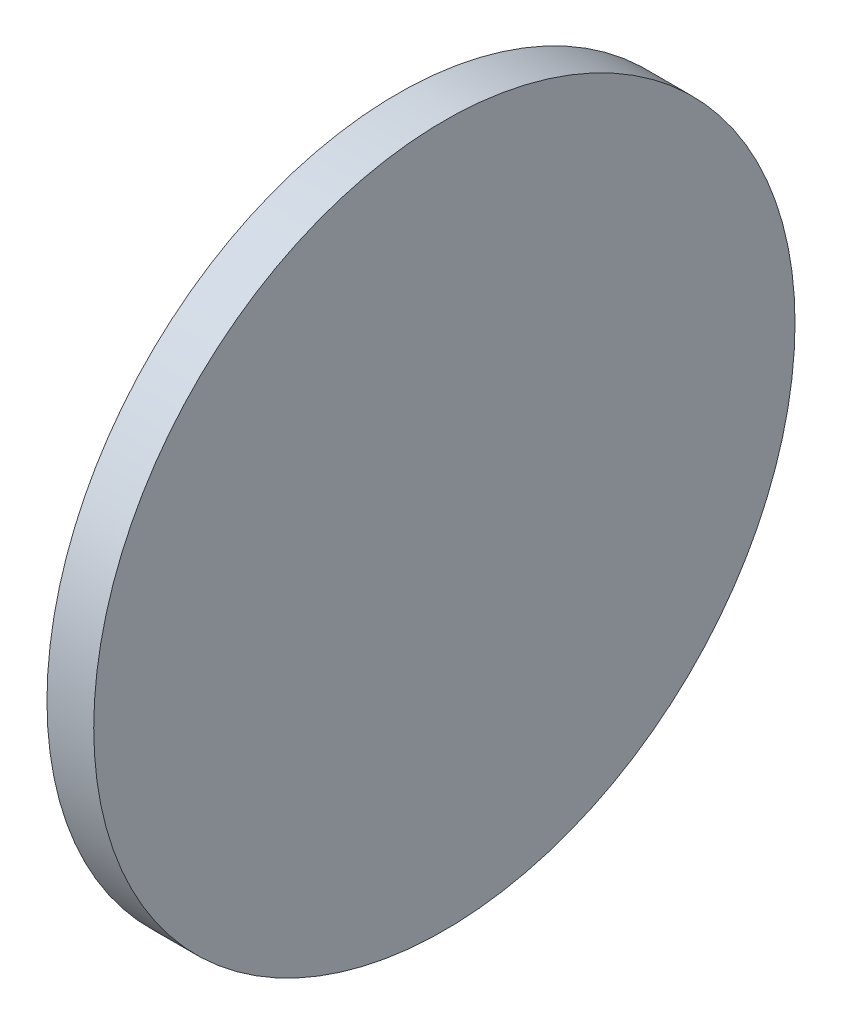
SolidWorks part; units mm, degrees
ref_plane "Front Plane" through (0, 0, 0) normal (0, 0, 1) x (1, 0, 0)
ref_plane "Top Plane" through (0, 0, 0) normal (0, 1, 0) x (1, 0, 0)
ref_plane "Right Plane" through (0, 0, 0) normal (1, 0, 0) x (0, 0, -1)
sketch "Sketch1" plane through (0, 0, 0) normal (1, 0, 0) x (0, 0, -1)
  circle A0 centre (0, 0) radius 9.525
  dimension "D1" = 19.05
extrude "Boss-Extrude1" add sketch "Sketch1" along normal blind 1.27 from offset 1
